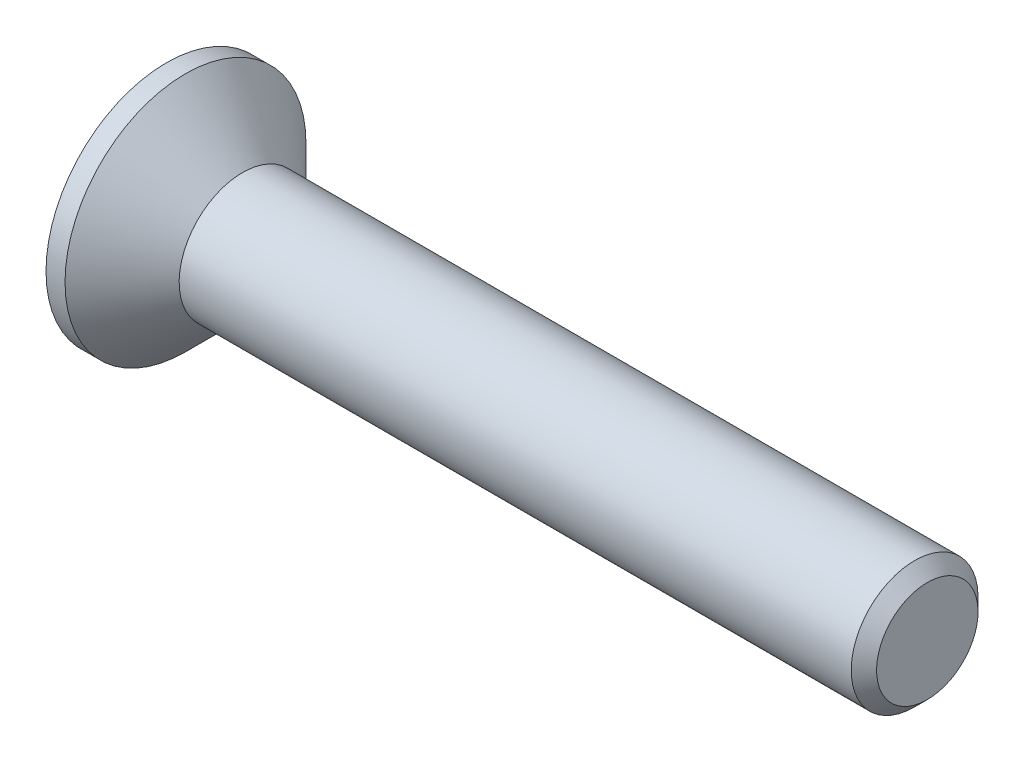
SolidWorks part; units mm, degrees
ref_plane "Front Plane" through (0, 0, 0) normal (0, 0, 1) x (1, 0, 0)
ref_plane "Top Plane" through (0, 0, 0) normal (0, 1, 0) x (1, 0, 0)
ref_plane "Right Plane" through (0, 0, 0) normal (1, 0, 0) x (0, 0, -1)
sketch "Sketch1" plane through (0, 0, 0) normal (0, 0, 1) x (1, 0, 0)
  line L1 (-1.2, 1.9) -> (-1.2, 0)
  line L2 (-1.2, 0) -> (10.8, 0)
  line L3 (10.8, 0) -> (10.8, 1)
  line L4 (10.8, 1) -> (0, 1)
  line L5 (-1.2, 1.9) -> (-0.9, 1.9)
  line L6 (-0.9, 1.9) -> (0, 1)
  dimension "D1" = 1
  dimension "D2" = 45
  dimension "D3" = 1.2
  dimension "D4" = 12
  dimension "D5" = 1.9
revolve "Revolve1" add sketch "Sketch1" angle 360 about L2
chamfer "Chamfer1" distance 0.2 angle 45 1 edges at (10.8, -1, 0)
sketch "Sketch2" plane through (-1.2, 0, 0) normal (-1, 0, 0) x (0, 0, 1)
  line L0 (-0.3, 1.175) -> (0.3, 1.175)
  line L1 (0.3, 1.175) -> (0.3, 0.3)
  line L2 (0.3, 0.3) -> (1.175, 0.3)
  line L3 (1.175, 0.3) -> (1.175, -0.3)
  line L4 (1.175, -0.3) -> (0.3, -0.3)
  line L5 (0.3, -0.3) -> (0.3, -1.175)
  line L6 (0.3, -1.175) -> (-0.3, -1.175)
  line L7 (-0.3, -1.175) -> (-0.3, -0.3)
  line L8 (-0.3, -0.3) -> (-1.175, -0.3)
  line L9 (-1.175, -0.3) -> (-1.175, 0.3)
  line L10 (-1.175, 0.3) -> (-0.3, 0.3)
  line L11 (-0.3, 0.3) -> (-0.3, 1.175)
  point P5 (0, 1.175)
  point P13 (1.175, 0)
  point P15 (-1.175, 0)
  point P16 (0, -1.175)
  point P17 (0.3, 1.085)
  dimension "D1" = 0.6
  dimension "D2" = 2.35
extrude "Cut-Extrude1" cut sketch "Sketch2" against normal blind 0.95
